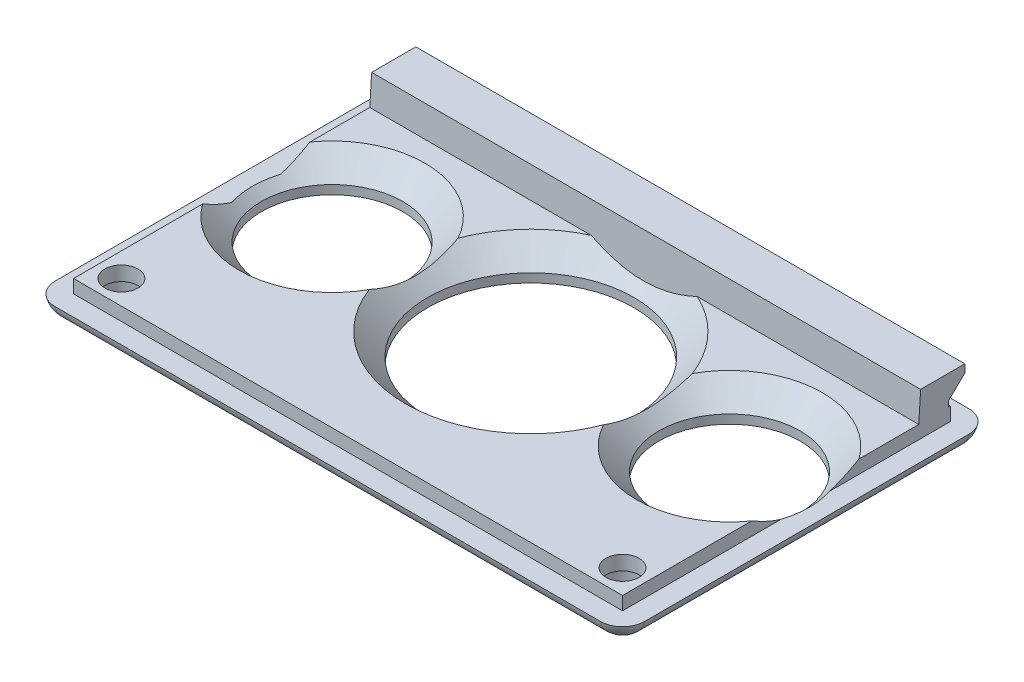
SolidWorks part; units mm, degrees
ref_plane "Front Plane" through (0, 0, 0) normal (0, 0, 1) x (1, 0, 0)
ref_plane "Top Plane" through (0, 0, 0) normal (0, 1, 0) x (1, 0, 0)
ref_plane "Right Plane" through (0, 0, 0) normal (1, 0, 0) x (0, 0, -1)
sketch "Sketch1" plane through (0, 0, 0) normal (0, 1, 0) x (1, 0, 0)
  line L1 (-1.2463, 1.173) -> (78.7537, 1.173)
  line L2 (-1.2463, 1.173) -> (-1.2463, 51.173)
  line L3 (-1.2463, 51.173) -> (78.7537, 51.173)
  line L4 (78.7537, 1.173) -> (78.7537, 51.173)
  dimension "D1" = 50
  dimension "D2" = 80
extrude "Boss-Extrude1" add sketch "Sketch1" along normal blind 2.4
sketch "Sketch2" plane through (0, 2.4, 0) normal (0, 1, 0) x (1, 0, 0)
  line L0 (38.7537, 51.173) -> (38.7537, 1.173) construction
  line L1 (78.7537, 51.173) -> (-1.2463, 51.173) construction
  line L2 (-1.2463, 1.173) -> (78.7537, 1.173) construction
  line L3 (-1.2463, 51.173) -> (-1.2463, 1.173) construction
  line L4 (1.5037, 48.423) -> (76.0037, 48.423)
  line L5 (1.5037, 48.423) -> (1.5037, 3.923)
  line L6 (1.5037, 3.923) -> (76.0037, 3.923)
  line L7 (76.0037, 48.423) -> (76.0037, 3.923)
  line L8 (1.5037, 48.423) -> (76.0037, 3.923) construction
  line L9 (1.5037, 3.923) -> (76.0037, 48.423) construction
  point P6 (38.7537, 26.173)
  dimension "D1" = 2.75
  dimension "D2" = 2.75
extrude "Boss-Extrude2" add sketch "Sketch2" along normal blind 1.8
sketch "Sketch3" [suppressed] plane through (0, 0, 0) normal (0, -1, 0) x (-1, 0, 0)
  line L1 (-74.0007, 57.8979) -> (-74.348, 7.8991) construction
  line L2 (-74.348, 7.8991) -> (0.6502, 7.3782) construction
  line L3 (0.6502, 7.3782) -> (0.9975, 57.377) construction
  line L4 (0.9975, 57.377) -> (-74.0007, 57.8979) construction
  circle A0 centre (-61.0257, 35.0904) radius 9.305
  circle A1 centre (-36.6576, 35.188) radius 13.2617
  circle A2 centre (-12.0957, 35.0904) radius 9.305
  circle A3 centre (-67.6316, 45.7049) radius 3.1
  circle A4 centre (-18.7016, 45.7049) radius 3.1
  circle A5 centre (-68.3065, 13.8573) radius 1.75
  circle A6 centre (-5.3158, 13.4277) radius 1.75
sketch "Sketch4" plane through (0, 0, 0) normal (0, -1, 0) x (-1, 0, 0)
  line L0 (-78.7537, 55.2723) -> (-78.7537, 28.723) construction
  line L1 (1.2463, 1.173) -> (-78.7537, 1.173) construction
  line L2 (-65.7187, 28.723) -> (-38.7537, 28.723) construction
  line L3 (-38.7537, 28.723) -> (-11.7887, 28.723) construction
  line L4 (-65.7187, 28.723) -> (-78.7537, 28.723) construction
  line L5 (-4.7537, 7.173) -> (-72.7537, 7.173) construction
  line L6 (-72.7537, 7.173) -> (-73.7537, 7.173) construction
  line L7 (-73.7537, 7.173) -> (-72.7537, 7.173) construction
  line L8 (-72.7537, 7.173) -> (-72.7537, 4.923) construction
  line L9 (-72.7537, 4.923) -> (-72.7537, 7.173) construction
  line L10 (-72.7537, 7.173) -> (-72.7537, 9.423) construction
  line L11 (-11.7887, 28.723) -> (-28.1542, 28.723) construction
  line L13 (-4.7537, 7.173) -> (-4.7537, 1.1651) construction
  line L14 (-4.7537, 1.1651) -> (-4.7537, 7.173) construction
  line L15 (-4.7537, 7.173) -> (-4.7537, 9.423) construction
  line L16 (-78.7537, 1.173) -> (-78.7537, 51.173) construction
  line L17 (-38.7537, 28.723) -> (-38.7537, 51.173) construction
  line L18 (-78.7537, 51.173) -> (1.2463, 51.173) construction
  line L19 (1.2463, 51.173) -> (1.2463, 1.173) construction
  circle A0 centre (-65.7187, 28.723) radius 9.6
  circle A1 centre (-38.7537, 28.723) radius 14
  circle A2 centre (-11.7887, 28.723) radius 9.6
  circle A3 centre (-72.7537, 7.173) radius 2.25
  circle A4 centre (-4.7537, 7.173) radius 2.25
extrude "Cut-Extrude1" cut sketch "Sketch4" against normal through all
sketch "Sketch5" plane through (76.0037, 0, 0) normal (1, 0, 0) x (0, 0, -1)
  line L0 (48.123, 4.2) -> (44.123, 4.2)
  line L1 (3.923, 4.2) -> (48.423, 4.2) construction
  line L2 (44.123, 4.2) -> (44.373, 8.2)
  line L3 (44.373, 8.2) -> (50.373, 8.2)
  line L4 (50.373, 8.2) -> (50.373, 7.1)
  line L6 (48.1425, 4.9783) -> (48.123, 4.2)
  line L7 (48.423, 4.2) -> (48.423, 2.4) construction
  line L8 (51.173, 2.4) -> (51.173, 0) construction
  line L9 (48.1425, 4.9783) -> (50.373, 7.1)
  dimension "D1" = 1.1
  dimension "D2" = 4
  dimension "D3" = 0.3
  dimension "D4" = 0.8
  dimension "D5" = 4
  dimension "D6" = 6
  dimension "D8" = 135
extrude "Boss-Extrude3" add sketch "Sketch5" against normal up to surface (74.5 mm away)
sketch "Sketch6" plane through (0, 0, 0) normal (0, -1, 0) x (1, 0, 0)
  line L0 (72.3246, -42.4375) -> (72.3246, -36.2375) construction
  line L1 (78.7537, -1.173) -> (78.7537, -51.173) construction
  line L3 (78.7537, -51.173) -> (-1.2463, -51.173) construction
  line L4 (-1.2463, -51.173) -> (-1.2463, -1.173) construction
  circle A0 centre (72.3246, -39.3375) radius 3.65
  circle A1 centre (18.3946, -39.3375) radius 3.65
  dimension "D1" = 7.3
  dimension "D2" = 6.429
  dimension "D3" = 11.8356
  dimension "D4" = 19.641
  dimension "D5" = 11.8356
extrude "Cut-Extrude2" [suppressed] cut sketch "Sketch6" against normal through all
fillet "Fillet1" radius 3 4 edges at (-1.2463, 1.2, -51.173) (-1.2463, 1.2, -1.173) (78.7537, 1.2, -1.173) (78.7537, 1.2, -51.173)
fillet "Fillet2" radius 3 8 edges at (-0.3677, 0, -50.2943) (38.7537, 0, -51.173) (77.875, 0, -50.2943) (78.7537, 0, -26.173) (77.875, 0, -2.0517) (38.7537, 0, -1.173) (-0.3677, 0, -2.0517) (-1.2463, 0, -26.173)
sketch "Sketch7" plane through (0, 0, 0) normal (0, -1, 0) x (1, 0, 0)
  circle A0 centre (4.7537, -7.173) radius 3
  circle A1 centre (72.7537, -7.173) radius 3
  dimension "D1" = 6
extrude "Cut-Extrude3" cut sketch "Sketch7" against normal blind 2.25
chamfer "Chamfer1" distance 3 angle 45 3 edges at (65.7187, 4.2, -38.323) (38.7537, 4.2, -42.723) (11.7887, 4.2, -38.323)
equation "\"ir distance\"=26.965"
equation "\"D3@Sketch4\"=\"ir distance\""
equation "\"D4@Sketch4\"=\"ir distance\""
